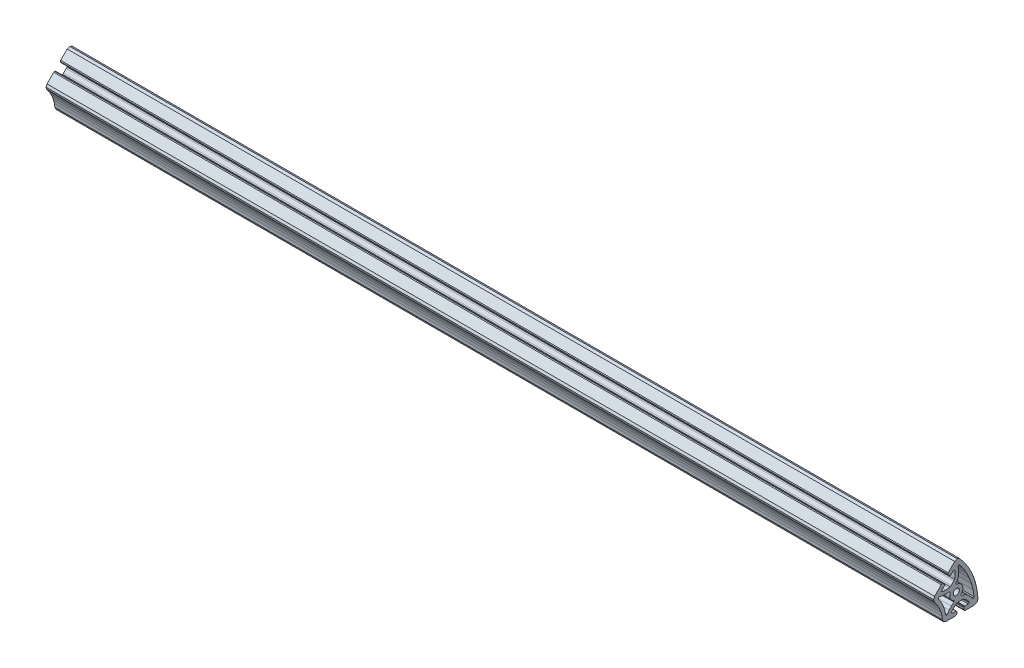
SolidWorks part; units mm, degrees
ref_plane "Ebene vorne" through (0, 0, 0) normal (0, 0, 1) x (1, 0, 0)
ref_plane "Ebene oben" through (0, 0, 0) normal (0, 1, 0) x (1, 0, 0)
ref_plane "Ebene rechts" through (0, 0, 0) normal (1, 0, 0) x (0, 0, -1)
sketch "Skizze1" plane through (0, 0, 0) normal (0, 1, 0) x (1, 0, 0)
  line L0 (0, 0) -> (1000, 0)
  dimension "D1" = 1000
other "Strukturbauteil1"
ref_plane "Ebene1" through (0, 0, 0) normal (1, 0, 0) x (0, 0, -1)
sketch "Model" plane through (0, 0, 0) normal (1, 0, 0) x (0, 0, -1)
  line L0 (-11.615, -22.961) -> (-0.9328, -22.961)
  line L1 (0.5672, -21.461) -> (0.5672, -19.461)
  line L2 (-0.4328, -18.461) -> (-4.3489, -18.461)
  line L3 (2.3742, -10.711) -> (6.7603, -10.711)
  line L4 (13.4833, -18.461) -> (9.5672, -18.461)
  line L5 (8.5672, -19.461) -> (8.5672, -21.461)
  line L6 (10.0672, -22.961) -> (20.4619, -22.961)
  line L7 (-1.7671, 30.7046) -> (-9.1173, 23.3545)
  line L8 (-9.1173, 21.2332) -> (-7.7031, 19.819)
  line L9 (-6.2889, 19.819) -> (-3.5551, 22.5527)
  line L10 (-2.7936, 12.3541) -> (-5.895, 9.2526)
  line L11 (-16.129, 9.9788) -> (-13.3599, 12.7479)
  line L12 (-13.3599, 14.1621) -> (-14.7741, 15.5763)
  line L13 (-16.8955, 15.5763) -> (-24.4489, 8.0229)
  line L14 (4.001, 30.5888) -> (9.7056, 23.4824)
  line L15 (9.7056, 23.4824) -> (14.5406, 15.8169)
  line L16 (14.5406, 15.8169) -> (18.4776, 7.6537)
  line L17 (18.4776, 7.6537) -> (21.466, -0.9024)
  line L18 (21.466, -0.9024) -> (23.4675, -9.7416)
  line L19 (-15.5935, -19.3744) -> (-14.2933, -21.932)
  line L20 (23.4675, -9.7416) -> (24.4587, -18.8004)
  line L21 (4.001, 30.5888) -> (1.1416, 31.8754)
  line L22 (-24.6943, 2.6348) -> (-22.2801, -0.5801)
  line L23 (-15.5744, 8.1494) -> (-16.3999, 8.8979)
  line L24 (-16.3999, 8.8979) -> (-16.129, 9.9788)
  line L25 (-1.6721, 14.5516) -> (-2.0592, 13.3642)
  line L26 (-1.6742, 21.9347) -> (-1.399, 18.2933)
  line L27 (-1.399, 18.2933) -> (-1.6721, 14.5516)
  line L28 (1.1416, 31.8754) -> (-1.7671, 30.7046)
  line L29 (-9.1173, 23.3545) -> (-9.5566, 22.2938)
  line L30 (14.3848, -16.7752) -> (14.4392, -17.8882)
  line L31 (14.4392, -17.8882) -> (13.4833, -18.461)
  line L32 (0.0272, -11.4719) -> (1.1406, -10.906)
  line L33 (-5.1919, -16.6941) -> (-2.8116, -13.9246)
  line L34 (-11.9234, -16.4084) -> (-12.597, -12.9063)
  line L35 (-12.597, -12.9063) -> (-13.552, -9.4703)
  line L36 (-20.0888, 4.3652) -> (-18.9616, 4.7623)
  line L37 (-18.9616, 4.7623) -> (-15.3388, 4.0777)
  line L38 (-7.8808, 4.1195) -> (-7.0088, 3.7372)
  line L40 (-13.552, -9.4703) -> (-14.7821, -6.1229)
  line L41 (-14.7821, -6.1229) -> (-16.2792, -2.8862)
  line L42 (6.159, -6.7322) -> (5.2371, -6.1623)
  line L43 (3.7882, 24.6697) -> (2.6194, 24.9121)
  line L44 (2.6194, 24.9121) -> (2.0691, 23.7639)
  line L45 (2.0691, 23.7639) -> (2.4326, 21.356)
  line L46 (-0.4054, 9.1154) -> (-0.6542, 8.0606)
  line L47 (-0.6542, 8.0606) -> (0.3039, 7.3938)
  line L48 (18.3235, -15.4228) -> (16.8211, -13.3809)
  line L49 (18.3235, -15.4228) -> (19.4677, -15.7634)
  line L50 (5.2371, -6.1623) -> (5.443, -5.0133)
  line L51 (19.4677, -15.7634) -> (20.1228, -14.7654)
  line L52 (-9.5566, 22.2938) -> (-9.1173, 21.2332)
  line L53 (-7.7031, 19.819) -> (-6.996, 19.5261)
  line L54 (-6.996, 19.5261) -> (-6.2889, 19.819)
  line L55 (-3.5551, 22.5527) -> (-2.415, 22.8514)
  line L56 (-2.415, 22.8514) -> (-1.6742, 21.9347)
  line L57 (-2.0592, 13.3642) -> (-2.7936, 12.3541)
  line L58 (-5.895, 9.2526) -> (-6.9052, 8.5182)
  line L59 (-6.9052, 8.5182) -> (-8.0926, 8.1311)
  line L60 (-15.5744, 8.1494) -> (-11.8342, 7.8581)
  line L61 (-11.8342, 7.8581) -> (-8.0926, 8.1311)
  line L62 (-13.3599, 12.7479) -> (-13.067, 13.455)
  line L63 (-13.067, 13.455) -> (-13.3599, 14.1621)
  line L64 (-14.7741, 15.5763) -> (-15.8348, 16.0157)
  line L65 (-15.8348, 16.0157) -> (-16.8955, 15.5763)
  line L66 (-24.4489, 8.0229) -> (-25.6151, 5.4014)
  line L67 (-25.6151, 5.4014) -> (-24.6943, 2.6348)
  line L68 (-22.2801, -0.5801) -> (-20.2009, -4.0212)
  line L69 (-20.2009, -4.0212) -> (-18.4776, -7.6537)
  line L70 (-18.4776, -7.6537) -> (-17.1276, -11.4408)
  line L71 (-17.1276, -11.4408) -> (-16.1647, -15.3442)
  line L72 (-16.1647, -15.3442) -> (-15.5935, -19.3744)
  line L73 (-14.2933, -21.932) -> (-11.615, -22.961)
  line L74 (-0.9328, -22.961) -> (0.1279, -22.5217)
  line L75 (0.1279, -22.5217) -> (0.5672, -21.461)
  line L76 (0.5672, -19.461) -> (0.2743, -18.7539)
  line L77 (0.2743, -18.7539) -> (-0.4328, -18.461)
  line L78 (-4.3489, -18.461) -> (-5.3047, -17.8882)
  line L79 (-5.3047, -17.8882) -> (-5.1919, -16.6941)
  line L80 (-2.8116, -13.9246) -> (0.0272, -11.4719)
  line L81 (1.1406, -10.906) -> (2.3742, -10.711)
  line L82 (6.7603, -10.711) -> (7.9939, -10.906)
  line L83 (7.9939, -10.906) -> (9.1876, -11.5314)
  line L84 (9.1876, -11.5314) -> (11.946, -13.9246)
  line L85 (11.946, -13.9246) -> (14.3848, -16.7752)
  line L86 (9.5672, -18.461) -> (8.8601, -18.7539)
  line L87 (8.8601, -18.7539) -> (8.5672, -19.461)
  line L88 (8.5672, -21.461) -> (9.0066, -22.5217)
  line L89 (9.0066, -22.5217) -> (10.0672, -22.961)
  line L90 (20.4619, -22.961) -> (23.3465, -21.7321)
  line L91 (23.3465, -21.7321) -> (24.4587, -18.8004)
  line L92 (3.7882, 24.6697) -> (8.0721, 18.7898)
  line L93 (8.0721, 18.7898) -> (11.7264, 12.6149)
  line L94 (11.7264, 12.6149) -> (14.7821, 6.1229)
  line L95 (14.7821, 6.1229) -> (17.2119, -0.6283)
  line L96 (17.2119, -0.6283) -> (18.9942, -7.5785)
  line L97 (18.9942, -7.5785) -> (20.1228, -14.7654)
  line L98 (2.4326, 21.356) -> (2.5928, 18.9262)
  line L99 (2.5928, 18.9262) -> (2.5486, 16.4915)
  line L100 (2.5486, 16.4915) -> (2.2856, 13.9702)
  line L101 (1.795, 12.1845) -> (2.2856, 13.9702)
  line L102 (1.795, 12.1845) -> (0.907, 10.5595)
  line L103 (0.907, 10.5595) -> (-0.4054, 9.1154)
  line L104 (16.8211, -13.3809) -> (15.2162, -11.5495)
  line L105 (15.2162, -11.5495) -> (13.4634, -9.8591)
  line L106 (13.4634, -9.8591) -> (11.4946, -8.2622)
  line L107 (9.885, -7.3465) -> (11.4946, -8.2622)
  line L108 (9.885, -7.3465) -> (8.108, -6.8253)
  line L109 (8.108, -6.8253) -> (6.159, -6.7322)
  line L110 (-10.0923, -16.8608) -> (-7.9628, -13.7296)
  line L111 (-7.9628, -13.7296) -> (-5.5156, -10.972)
  line L112 (-5.5156, -10.972) -> (-2.6597, -8.4855)
  line L113 (-2.6597, -8.4855) -> (-2.3134, -7.5985)
  line L114 (-2.3134, -7.5985) -> (-2.9581, -6.7831)
  line L115 (-11.1183, -17.2915) -> (-10.0923, -16.8608)
  line L116 (-11.1183, -17.2915) -> (-11.9234, -16.4084)
  line L117 (-16.2792, -2.8862) -> (-18.0336, 0.2187)
  line L118 (-18.0336, 0.2187) -> (-20.092, 3.2525)
  line L119 (-20.0888, 4.3652) -> (-20.092, 3.2525)
  line L120 (-15.3388, 4.0777) -> (-11.6585, 3.8582)
  line L121 (-11.6585, 3.8582) -> (-7.8808, 4.1195)
  line L122 (-7.0088, 3.7372) -> (-6.888, 2.7047)
  circle A0 centre (0, 0) radius 3.4
  arc A36 (5.443, -5.0133) -> (0.3039, 7.3938) centre (0, 0) ccw
  arc A40 (-6.888, 2.7047) -> (-2.9581, -6.7831) centre (0, 0) ccw
  point P15 (0.907, 10.5595)
  point P34 (0, 0)
  point P70 (23.4675, -9.7416)
  point P74 (1.795, 12.1845)
  point P75 (2.5486, 16.4915)
  point P93 (21.466, -0.9024)
  point P94 (18.4776, 7.6537)
  point P95 (14.5406, 15.8169)
  point P96 (9.7056, 23.4824)
  point P97 (18.9942, -7.5785)
  point P98 (17.2119, -0.6283)
  point P99 (14.7821, 6.1229)
  point P100 (11.7264, 12.6149)
  point P102 (-13.0064, 19.4654)
  point P103 (4.5672, -22.961)
  point P104 (-18.4776, -7.6537)
  point P105 (18.4776, 7.6537)
  point P106 (8.0721, 18.7898)
  point P117 (2.5928, 18.9262)
  point P137 (-12.597, -12.9063)
  point P138 (-13.552, -9.4703)
  point P139 (-14.7821, -6.1229)
  point P140 (-16.2792, -2.8862)
  point P141 (-18.0336, 0.2187)
  point P142 (-16.1647, -15.3442)
  point P143 (-17.1276, -11.4408)
  point P144 (-18.4776, -7.6537)
  point P145 (-20.2009, -4.0212)
  point P147 (-22.2801, -0.5801)
  point P157 (2.4326, 21.356)
  point P158 (16.8211, -13.3809)
  point P159 (15.2162, -11.5495)
  point P160 (13.4634, -9.8591)
  point P161 (9.885, -7.3465)
  point P162 (8.108, -6.8253)
  point P163 (-5.5156, -10.972)
  point P164 (-7.9628, -13.7296)
  point P165 (-15.3388, 4.0777)
  point P166 (-11.6585, 3.8582)
